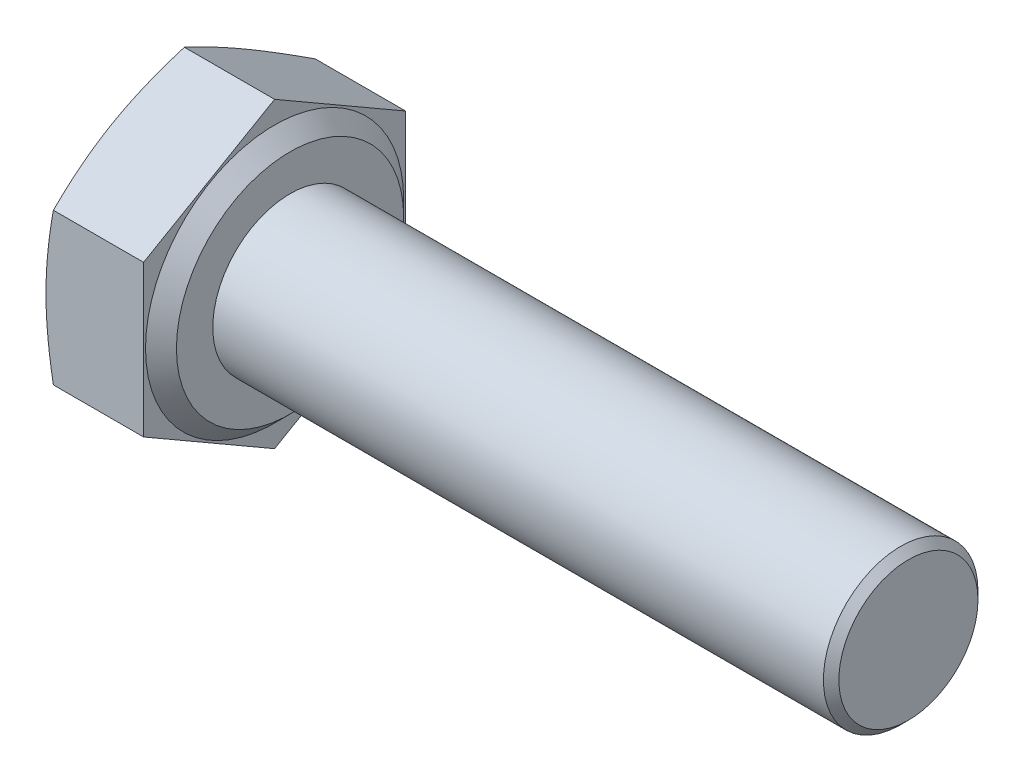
SolidWorks part; units mm, degrees
ref_plane "Front" through (0, 0, 0) normal (0, 0, 1) x (1, 0, 0)
ref_plane "Top" through (0, 0, 0) normal (0, 1, 0) x (1, 0, 0)
ref_plane "Right" through (0, 0, 0) normal (1, 0, 0) x (0, 0, -1)
sketch "Sketch2" plane through (0, 0, 0) normal (1, 0, 0) x (0, 0, -1)
  line L1 (3.39, -1.9572) -> (3.39, 1.9572)
  line L2 (3.39, 1.9572) -> (0, 3.9144)
  line L3 (0, 3.9144) -> (-3.39, 1.9572)
  line L4 (-3.39, 1.9572) -> (-3.39, -1.9572)
  line L5 (-3.39, -1.9572) -> (0, -3.9144)
  line L6 (0, -3.9144) -> (3.39, -1.9572)
  circle A0 centre (0, 0) radius 3.39 construction
  dimension "s" = 6.78
extrude "BaseHead" add sketch "Sketch2" along normal blind 2.925
sketch "Sketch3" plane through (0, 0, 0) normal (0, 0, 1) x (1, 0, 0)
  line L0 (2.925, 3.9144) -> (2.925, 2.94)
  line L2 (2.925, 2.94) -> (2.525, 3.34)
  line L3 (2.525, 3.34) -> (2.525, 3.9144)
  line L5 (2.525, 3.9144) -> (2.925, 3.9144)
  line L6 (-0.9571, 0) -> (7.6478, 0) construction
  line L7 (2.925, 3.9144) -> (0, 3.9144) construction
  dimension "D1" = 45
  dimension "c" = 0.4
  dimension "Dw" = 2.94
revolve "BearingFace" cut sketch "Sketch3" angle 360 about L6
sketch "Sketch4" plane through (0, 0, 0) normal (0, 0, 1) x (1, 0, 0)
  line L0 (-0.4935, 0) -> (3.5626, 0) construction
  line L2 (0, 3.9144) -> (0.1909, 3.9144)
  line L4 (0.1909, 3.9144) -> (0, 3.39)
  line L6 (0, 3.39) -> (0, 3.9144)
  line L7 (2.525, 3.9144) -> (0, 3.9144) construction
  dimension "D1" = 20
  dimension "D2" = 6.78
revolve "HeadChamfer" cut sketch "Sketch4" angle 360 about L0
sketch "Sketch5" plane through (2.925, 0, 0) normal (1, 0, 0) x (0, 0, -1)
  circle A0 centre (0, 0) radius 2
  dimension "d" = 4
extrude "BaseBody" add sketch "Sketch5" along normal blind 16
chamfer "Chamfer1" distance 0.2 angle 45 1 edges at (18.925, 0, -2)
fillet "HeadFillet" [suppressed] radius 0.2
sketch "Sketch6" plane through (0, 0, 0) normal (0, 0, 1) x (1, 0, 0)
  line L0 (2.925, 2.379) -> (3.304, 2.379)
  line L1 (3.304, 2.379) -> (3.304, 2)
  line L2 (3.304, 2) -> (3.1145, 1.6718)
  line L3 (3.1145, 1.6718) -> (2.925, 2)
  line L4 (2.925, 2) -> (2.925, 2.379)
  line L5 (18.725, 2) -> (2.925, 2) construction
  line L6 (2.925, -2.94) -> (2.925, 2.94) construction
  dimension "D1" = 0.379
revolve "Cut-Revolve10" [suppressed] cut sketch "Sketch6" angle 360 about axis through (-0.9571, 0, 0) along (1, 0, 0)
pattern_linear "LPattern10" [suppressed] count 35
equation "\"D2@Sketch4\" = \"s@Sketch2\""
equation "\"D1@Chamfer1\" = 0.05 * \"d@Sketch5\""
equation "\"D1@Sketch6\" =  ( \"d@Sketch5\" - \"D2@ThreadCosmetic1\" )  / 2"
equation "\"pitch@LPattern10\" = \"D1@Sketch6\" * 1.2"
equation "\"D1@LPattern10\" = \"l@BaseBody\" / \"pitch@LPattern10\""
